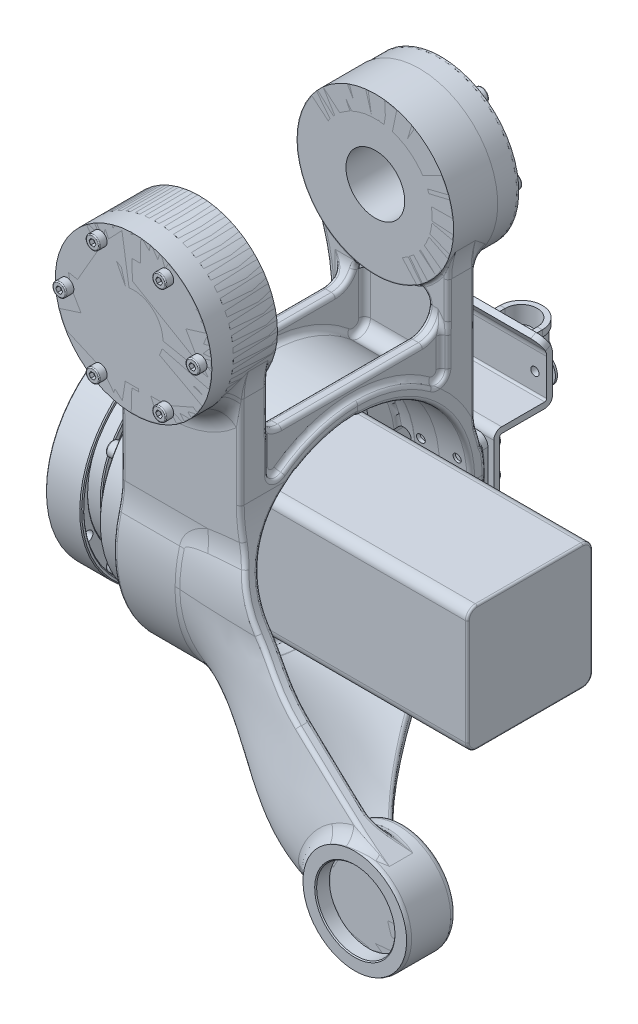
SolidWorks part; units mm, degrees
ref_plane "前视基准面" through (0, 0, 0) normal (0, 0, 1) x (1, 0, 0)
ref_plane "上视基准面" through (0, 0, 0) normal (0, 1, 0) x (1, 0, 0)
ref_plane "右视基准面" through (0, 0, 0) normal (1, 0, 0) x (0, 0, -1)
imported_body "RP150603腕部法兰（配S144O型圈）-1-surface1"
imported_body "GB_FASTENER_SCREWS_HSHCS M4X35-N-13-surface1"
imported_body "GB_FASTENER_SCREWS_HSHCS M4X35-N-14-surface1"
imported_body "GB_FASTENER_SCREWS_HSHCS M4X35-N-15-surface1"
imported_body "GB_FASTENER_SCREWS_HSHCS M4X35-N-16-surface1"
imported_body "GB_FASTENER_SCREWS_HSHCS M4X35-N-17-surface1"
imported_body "GB_FASTENER_SCREWS_HSHCS M4X35-N-18-surface1"
imported_body "GB_FASTENER_SCREWS_HSHCS M4X35-N-20-surface1"
imported_body "GB_FASTENER_SCREWS_HSHCS M4X35-N-21-surface1"
imported_body "GB_FASTENER_SCREWS_HSHCS M4X35-N-22-surface1"
imported_body "GB_FASTENER_SCREWS_HSHCS M4X35-N-22-surface2"
imported_body "GB_FASTENER_SCREWS_HSHCS M4X35-N-23-surface1"
imported_body "GB_FASTENER_SCREWS_HSHCS M4X35-N-24-surface1"
imported_body "RP150604腕部支架-1-surface1"
imported_body "LHSG-25-XXX-C-III 2022.01.04-1-surface1"
imported_body "LHSG-25-XXX-C-III 2022.01.04-1-surface3"
imported_body "LHSG-25-XXX-C-III 2022.01.04-1-surface4"
imported_body "LHSG-25-XXX-C-III 2022.01.04-1-surface5"
imported_body "LHSG-25-XXX-C-III 2022.01.04-1-surface6"
imported_body "LHSG-25-XXX-C-III 2022.01.04-1-surface7"
imported_body "RP150508盖板-1-surface1"
imported_body "RP150508盖板-2-surface1"
imported_body "GB_FASTENER_SCREWS_HSHCS M4X10-N-62-surface1"
imported_body "GB_FASTENER_SCREWS_HSHCS M4X10-N-63-surface1"
imported_body "GB_FASTENER_SCREWS_HSHCS M4X10-N-64-surface1"
imported_body "GB_FASTENER_SCREWS_HSHCS M4X10-N-65-surface1"
imported_body "GB_FASTENER_SCREWS_HSHCS M4X10-N-65-surface2"
imported_body "GB_FASTENER_SCREWS_HSHCS M4X10-N-66-surface1"
imported_body "GB_FASTENER_SCREWS_HSHCS M4X10-N-67-surface1"
imported_body "GB_FASTENER_SCREWS_HSHCS M4X10-N-68-surface1"
imported_body "GB_FASTENER_SCREWS_HSHCS M4X10-N-69-surface1"
imported_body "GB_FASTENER_SCREWS_HSHCS M4X10-N-70-surface1"
imported_body "GB_FASTENER_SCREWS_HSHCS M4X10-N-71-surface1"
imported_body "GB_FASTENER_SCREWS_HSHCS M4X10-N-71-surface2"
imported_body "GB_FASTENER_SCREWS_HSHCS M4X10-N-72-surface1"
imported_body "GB_FASTENER_SCREWS_HSHCS M4X10-N-72-surface2"
imported_body "GB_FASTENER_SCREWS_HSHCS M4X10-N-73-surface1"
imported_body "GB_FASTENER_SCREWS_HSHCS M5X12-N-74-surface1"
imported_body "GB_FASTENER_SCREWS_HSHCS M5X12-N-74-surface2"
imported_body "GB_FASTENER_SCREWS_HSHCS M5X12-N-75-surface1"
imported_body "GB_FASTENER_SCREWS_HSHCS M5X12-N-75-surface2"
imported_body "GB_FASTENER_SCREWS_HSHCS M5X12-N-76-surface1"
imported_body "GB_FASTENER_SCREWS_HSHCS M5X12-N-76-surface2"
imported_body "GB_FASTENER_SCREWS_HSHCS M5X12-N-77-surface1"
imported_body "GB_FASTENER_SCREWS_HSHCS M5X12-N-77-surface2"
imported_body "GB_FASTENER_SCREWS_HSHCS M5X20-N-78-surface1"
imported_body "GB_FASTENER_SCREWS_HSHCS M5X20-N-79-surface1"
imported_body "GB_FASTENER_SCREWS_HSHCS M5X20-N-79-surface2"
imported_body "GB_FASTENER_SCREWS_HSHCS M5X20-N-80-surface1"
imported_body "GB_FASTENER_SCREWS_HSHCS M5X20-N-81-surface1"
imported_body "GB_FASTENER_SCREWS_HSHCS M5X20-N-81-surface2"
imported_body "RP150601腕部壳体-20220107-1-surface1"
imported_body "RP150601腕部壳体-20220107-1-surface2"
imported_body "RP150606 腕部挡板-2-surface1"
imported_body "骑马卡 U形 (18-A型 连胶条)-1-surface1"
imported_body "骑马卡 U形 (18-A型 连胶条)-1-surface2"
imported_body "GB_FASTENER_SCREWS_HSHCS M4X30-N-47-surface1"
imported_body "GB_FASTENER_SCREWS_HSHCS M4X30-N-32-surface1"
imported_body "GB_FASTENER_SCREWS_HSHCS M4X30-N-32-surface2"
imported_body "GB_FASTENER_SCREWS_HSHCS M4X30-N-33-surface1"
imported_body "GB_FASTENER_SCREWS_HSHCS M4X30-N-34-surface1"
imported_body "GB_FASTENER_SCREWS_HSHCS M4X30-N-35-surface1"
imported_body "GB_FASTENER_SCREWS_HSHCS M4X30-N-36-surface1"
imported_body "GB_FASTENER_SCREWS_HSHCS M4X30-N-37-surface1"
imported_body "GB_FASTENER_SCREWS_HSHCS M4X30-N-37-surface2"
imported_body "GB_FASTENER_SCREWS_HSHCS M4X30-N-38-surface1"
imported_body "GB_FASTENER_SCREWS_HSHCS M4X30-N-39-surface1"
imported_body "GB_FASTENER_SCREWS_HSHCS M4X30-N-40-surface1"
imported_body "GB_FASTENER_SCREWS_HSHCS M4X30-N-41-surface1"
imported_body "ABP00 PT1-16 内六角堵头-3-surface1"
imported_body "ABP00 PT1-16 内六角堵头-3-surface2"
imported_body "ABP00 PT1-16 内六角堵头-4-surface1"
sketch "草图1" plane through (0, 0, -78.5) normal (0, 0, -1) x (-1, 0, 0)
  circle A0 centre (-75, 120) radius 39.75 construction
  circle A1 centre (-75, 120) radius 39.75
  circle A2 centre (-75, 120) radius 15
  dimension "D1" = 30
extrude "凸台-拉伸2" add sketch "草图1" against normal blind 33.5
sketch "草图2" plane through (0, 0, 78.5) normal (0, 0, 1) x (1, 0, 0)
  circle A0 centre (75, 120) radius 40
  circle A1 centre (75, 120) radius 15
  dimension "D1" = 80
  dimension "D2" = 30
extrude "凸台-拉伸3" add sketch "草图2" against normal blind 33.5 separate body
sketch "草图4" plane through (75, 0, 0) normal (1, 0, 0) x (0, 0, -1)
  line L0 (-34, -27) -> (-34, 27) construction
  line L1 (-34, -27) -> (-34, 27)
  line L2 (-27, 34) -> (27, 34) construction
  line L3 (-27, 34) -> (27, 34)
  line L4 (34, 27) -> (34, -27) construction
  line L5 (34, 27) -> (34, -27)
  line L6 (27, -34) -> (-27, -34) construction
  line L7 (27, -34) -> (-27, -34)
  arc A0 (-27, 34) -> (-34, 27) centre (-27, 27) ccw construction
  arc A1 (-27, 34) -> (-34, 27) centre (-27, 27) ccw
  arc A2 (34, 27) -> (27, 34) centre (27, 27) ccw construction
  arc A3 (34, 27) -> (27, 34) centre (27, 27) ccw
  arc A4 (27, -34) -> (34, -27) centre (27, -27) ccw construction
  arc A5 (27, -34) -> (34, -27) centre (27, -27) ccw
  arc A6 (-34, -27) -> (-27, -34) centre (-27, -27) ccw construction
  arc A7 (-34, -27) -> (-27, -34) centre (-27, -27) ccw
extrude "凸台-拉伸4" add sketch "草图4" along normal up to surface (7 mm away) separate body
sketch "草图5" plane through (82, 0, 0) normal (1, 0, 0) x (0, 0, -1)
  line L0 (27, 32) -> (-27, 32) construction
  line L1 (27, 32) -> (-27, 32)
  line L2 (-32, 27) -> (-32, -27) construction
  line L3 (-32, 27) -> (-32, -27)
  line L6 (-27, -32) -> (27, -32) construction
  line L7 (-27, -32) -> (27, -32)
  line L8 (32, -27) -> (32, 27) construction
  line L9 (32, -27) -> (32, 27)
  arc A0 (-27, 32) -> (-32, 27) centre (-27, 27) ccw construction
  arc A1 (-27, 32) -> (-32, 27) centre (-27, 27) ccw
  arc A2 (32, 27) -> (27, 32) centre (27, 27) ccw construction
  arc A3 (32, 27) -> (27, 32) centre (27, 27) ccw
  arc A4 (-32, -27) -> (-27, -32) centre (-27, -27) ccw construction
  arc A5 (-32, -27) -> (-27, -32) centre (-27, -27) ccw
  arc A6 (27, -32) -> (32, -27) centre (27, -27) ccw construction
  arc A7 (27, -32) -> (32, -27) centre (27, -27) ccw
extrude "凸台-拉伸5" add sketch "草图5" along normal blind 117 separate body
fillet "圆角1" radius 1 8 edges at (199, 30.5355, 30.5355) (199, 32, 0) (199, 30.5355, -30.5355) (199, 0, -32) (199, -30.5355, -30.5355) (199, -32, 0) (199, -30.5355, 30.5355) (199, 0, 32)
sketch "草图6" plane through (0, 0, 78.5) normal (0, 0, 1) x (1, 0, 0)
  circle A0 centre (195.0035, -76.212) radius 20 construction
  circle A1 centre (195.0035, -76.212) radius 20
extrude "凸台-拉伸7" add sketch "草图6" against normal blind 18 separate body
